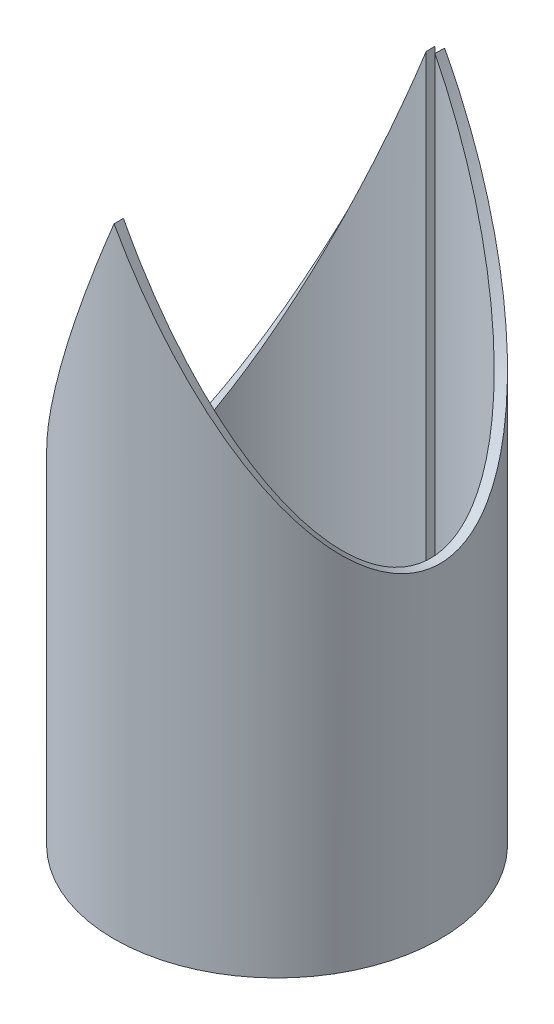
SolidWorks part; units mm, degrees
ref_plane "前视基准面" through (0, 0, 0) normal (0, 0, 1) x (1, 0, 0)
ref_plane "上视基准面" through (0, 0, 0) normal (0, 1, 0) x (1, 0, 0)
ref_plane "右视基准面" through (0, 0, 0) normal (1, 0, 0) x (0, 0, -1)
imported_body "基体零件-任意角度四通管-1"
sheet metal parameters "钣金1" parameters "D1"=0.7366, "厚度"=1
bend "圆角折弯1" bend radius 16.3631 bend angle 356.7 parameters "D5"=1
flatten bends "展开-折弯1"
sketch "尖角-草图1" plane through (0.5, -33.4516, -17.3559) normal (0.0288, 0, -0.9996) x (-0.9996, 0, -0.0288)
  line L0 (-50.9349, -32.5484) -> (-50.9349, 32.3964) construction
  dimension "D1" = 0
process bends "加工-折弯1" parameters "D1"=0
sketch "平面-草图1" plane through (0.5, -33.4516, -17.3559) normal (0.0288, 0, -0.9996) x (-0.9996, 0, -0.0288)
